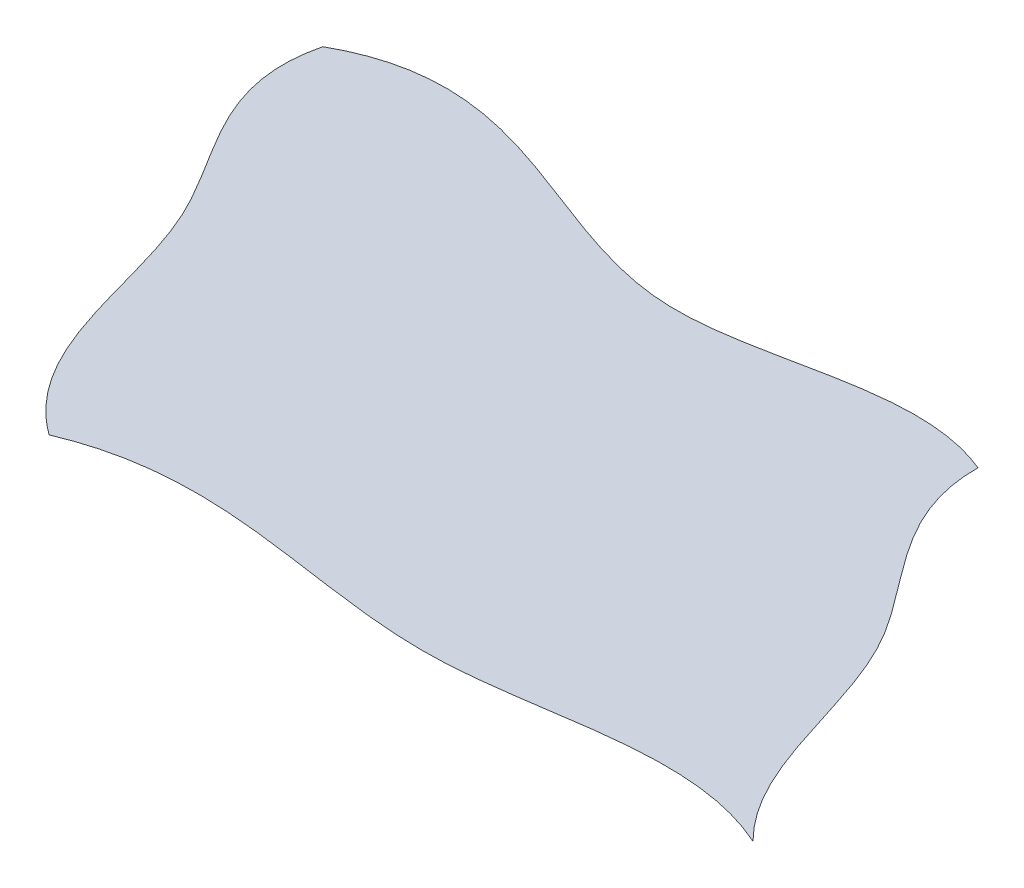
SolidWorks part; units mm, degrees
ref_plane "Front Plane" through (0, 0, 0) normal (0, 0, 1) x (1, 0, 0)
ref_plane "Top Plane" through (0, 0, 0) normal (0, 1, 0) x (1, 0, 0)
ref_plane "Right Plane" through (0, 0, 0) normal (1, 0, 0) x (0, 0, -1)
sketch "Sketch1" plane through (0, 0, 0) normal (0, 1, 0) x (1, 0, 0)
  spline S0 degree 3 poles (-65.5063, 0) (-43.7161, 9.2634) (-3.6566, -8.7136) (36.2524, 8.0847) (54.287, 0) knots 0 0 0 0 0.5462 1 1 1 1
  spline S1 degree 3 poles (-99.4296, 80.5011) (-75.9299, 93.784) (-39.1761, 57.3244) (1.5538, 81.1548) (18.3738, 74.202) knots 0 0 0 0 0.572407 1 1 1 1
  spline S2 degree 3 poles (-99.4296, 80.5011) (-103.035, 65.6311) (-79.0924, 43.8701) (-80.6482, 11.1136) (-65.5063, 0) knots 0 0 0 0 0.438321 1 1 1 1
  spline S3 degree 3 poles (18.3738, 74.202) (18.2925, 59.7282) (42.6108, 41.6351) (43.2523, 11.0094) (54.287, 0) knots 0 0 0 0 0.463897 1 1 1 1
  spline S4 degree 3 poles (-86.9448, 44.442) (-63.5847, 38.7633) (-22.4527, 40.8937) (18.4872, 40.0839) (35.7596, 40.2445) knots 0 0 0 0 0.578904 1 1 1 1
  spline S5 degree 3 poles (0, 0) (-7.6531, 12.3863) (-11.6683, 39.4674) (-28.8623, 60.376) (-32.5509, 71.7986) knots 0 0 0 0 0.548653 1 1 1 1
other "Boundary-Surface1"
